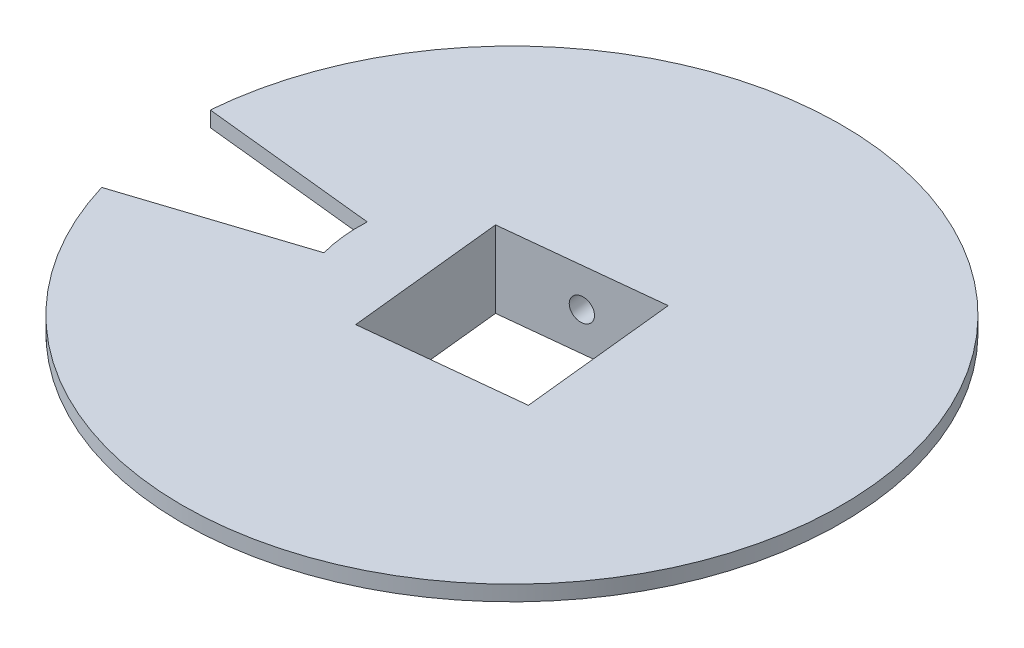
SolidWorks part; units mm, degrees
ref_plane "Front Plane" through (0, 0, 0) normal (0, 0, 1) x (1, 0, 0)
ref_plane "Top Plane" through (0, 0, 0) normal (0, 1, 0) x (1, 0, 0)
ref_plane "Right Plane" through (0, 0, 0) normal (1, 0, 0) x (0, 0, -1)
sketch "Sketch1" plane through (0, 0, 0) normal (0, 1, 0) x (1, 0, 0)
  line L0 (-1.8271, 0.8135) -> (1.8271, -0.8135)
  line L1 (-2, 0) -> (2, 0)
  line L2 (-2, 0) -> (-2, -89.9778)
  line L3 (-2, -89.9778) -> (2, -89.9778)
  line L4 (2, 0) -> (2, -89.9778)
  line L5 (-1.8271, 0.8135) -> (-38.4243, -81.3853)
  line L6 (-38.4243, -81.3853) -> (-34.7702, -83.0123)
  line L7 (1.8271, -0.8135) -> (-34.7702, -83.0123)
  line L8 (-1.3383, 1.4863) -> (1.3383, -1.4863)
  line L9 (-1.3383, 1.4863) -> (-68.2048, -58.7206)
  line L10 (-68.2048, -58.7206) -> (-65.5283, -61.6932)
  line L11 (1.3383, -1.4863) -> (-65.5283, -61.6932)
  line L12 (-0.618, 1.9021) -> (0.618, -1.9021)
  line L13 (-0.618, 1.9021) -> (-86.192, -25.9025)
  line L14 (-86.192, -25.9025) -> (-84.9559, -29.7068)
  line L15 (0.618, -1.9021) -> (-84.9559, -29.7068)
  line L16 (0.2091, 1.989) -> (-0.2091, -1.989)
  line L17 (0.2091, 1.989) -> (-89.2758, 11.3943)
  line L18 (-89.2758, 11.3943) -> (-89.6939, 7.4162)
  line L19 (-0.2091, -1.989) -> (-89.6939, 7.4162)
  line L20 (1, 1.7321) -> (-1, -1.7321)
  line L21 (1, 1.7321) -> (-76.923, 46.7209)
  line L22 (-76.923, 46.7209) -> (-78.923, 43.2568)
  line L23 (-1, -1.7321) -> (-78.923, 43.2568)
  line L24 (1.618, 1.1756) -> (-1.618, -1.1756)
  line L25 (1.618, 1.1756) -> (-51.2696, 73.9691)
  line L26 (-51.2696, 73.9691) -> (-54.5056, 71.618)
  line L27 (-1.618, -1.1756) -> (-54.5056, 71.618)
  line L28 (1.9563, 0.4158) -> (-1.9563, -0.4158)
  line L29 (1.9563, 0.4158) -> (-16.7511, 88.4274)
  line L30 (-16.7511, 88.4274) -> (-20.6637, 87.5957)
  line L31 (-1.9563, -0.4158) -> (-20.6637, 87.5957)
  line L32 (1.9563, -0.4158) -> (-1.9563, 0.4158)
  line L33 (1.9563, -0.4158) -> (20.6637, 87.5957)
  line L34 (20.6637, 87.5957) -> (16.7511, 88.4274)
  line L35 (-1.9563, 0.4158) -> (16.7511, 88.4274)
  line L36 (1.618, -1.1756) -> (-1.618, 1.1756)
  line L37 (1.618, -1.1756) -> (54.5056, 71.618)
  line L38 (54.5056, 71.618) -> (51.2696, 73.9691)
  line L39 (-1.618, 1.1756) -> (51.2696, 73.9691)
  line L40 (1, -1.7321) -> (-1, 1.7321)
  line L41 (1, -1.7321) -> (78.923, 43.2568)
  line L42 (78.923, 43.2568) -> (76.923, 46.7209)
  line L43 (-1, 1.7321) -> (76.923, 46.7209)
  line L44 (0.2091, -1.989) -> (-0.2091, 1.989)
  line L45 (0.2091, -1.989) -> (89.6939, 7.4162)
  line L46 (89.6939, 7.4162) -> (89.2758, 11.3943)
  line L47 (-0.2091, 1.989) -> (89.2758, 11.3943)
  line L48 (-0.618, -1.9021) -> (0.618, 1.9021)
  line L49 (-0.618, -1.9021) -> (84.9559, -29.7068)
  line L50 (84.9559, -29.7068) -> (86.192, -25.9025)
  line L51 (0.618, 1.9021) -> (86.192, -25.9025)
  line L52 (-1.3383, -1.4863) -> (1.3383, 1.4863)
  line L53 (-1.3383, -1.4863) -> (65.5283, -61.6932)
  line L54 (65.5283, -61.6932) -> (68.2048, -58.7206)
  line L55 (1.3383, 1.4863) -> (68.2048, -58.7206)
  line L56 (-1.8271, -0.8135) -> (1.8271, 0.8135)
  line L57 (-1.8271, -0.8135) -> (34.7702, -83.0123)
  line L58 (34.7702, -83.0123) -> (38.4243, -81.3853)
  line L59 (1.8271, 0.8135) -> (38.4243, -81.3853)
  circle A1 centre (0, 0) radius 90
  point P7 (0, 0)
  point P126 (0, 0)
  dimension "D1" = 180
  dimension "D2" = 4
  dimension "D3" = 15
sketch "Sketch7" plane through (0, 0, 0) normal (0, 0, 1) x (1, 0, 0)
  line L6 (0, 0) -> (-86, 0)
  line L7 (0, 0) -> (0, -4)
  line L8 (0, -4) -> (-86, -4)
  line L9 (-86, 0) -> (-86, -4)
  dimension "D1" = 4
  dimension "D2" = 86
revolve "Revolve4" add sketch "Sketch7" angle 360 about L7
sketch "Sketch9" plane through (0, 0, 0) normal (0, 1, 0) x (1, 0, 0)
  circle A0 centre (0, 0) radius 40
  dimension "D1" = 80
extrude "Cut-Extrude3" cut sketch "Sketch9" against normal through all and the other way through all
extrude "Cut-Extrude4" cut sketch "Sketch1" against normal through all contours L19 A1 L13
ref_plane "Plane1" through (0, 0, 0) normal (0, -1, 0) x (-1, 0, 0)
sketch "Sketch10" plane through (0, 0, 0) normal (0, -1, 0) x (-1, 0, 0)
  circle A0 centre (0, 0) radius 40
extrude "Boss-Extrude1" add sketch "Sketch10" along normal blind 20
sketch "Sketch14" plane through (0, 0, 0) normal (0, 1, 0) x (1, 0, 0)
  line L0 (-39.7809, -4.1811) -> (0, 0) construction
  line L1 (18.2449, 22.5305) -> (-22.5305, 18.2449)
  line L2 (-22.5305, 18.2449) -> (-18.2449, -22.5305)
  line L3 (-18.2449, -22.5305) -> (22.5305, -18.2449)
  line L4 (22.5305, -18.2449) -> (18.2449, 22.5305)
  arc A1 (-39.9402, 2.1869) -> (-38.6127, -10.4431) centre (0, 0) ccw construction
  arc A10 (-39.9402, 2.1869) -> (-38.6127, -10.4431) centre (0, 0) ccw construction
  dimension "D3" = 20.5
  dimension "D1" = 41
  dimension "D2" = 20.5
extrude "Cut-Extrude7" cut sketch "Sketch14" against normal through all
sketch "Sketch15" plane through (-2.1428, 0, -20.3877) normal (0.1045, 0, 0.9945) x (0.9945, 0, -0.1045)
  line L0 (20.5, 0) -> (-20.5, 0) construction
  line L2 (20.5, -20) -> (20.5, 0) construction
  circle A0 centre (0, -10) radius 3
  dimension "D1" = 6
  dimension "D2" = 10
  dimension "D4" = 20.5
extrude "Cut-Extrude8" cut sketch "Sketch15" against normal through all and the other way through all
